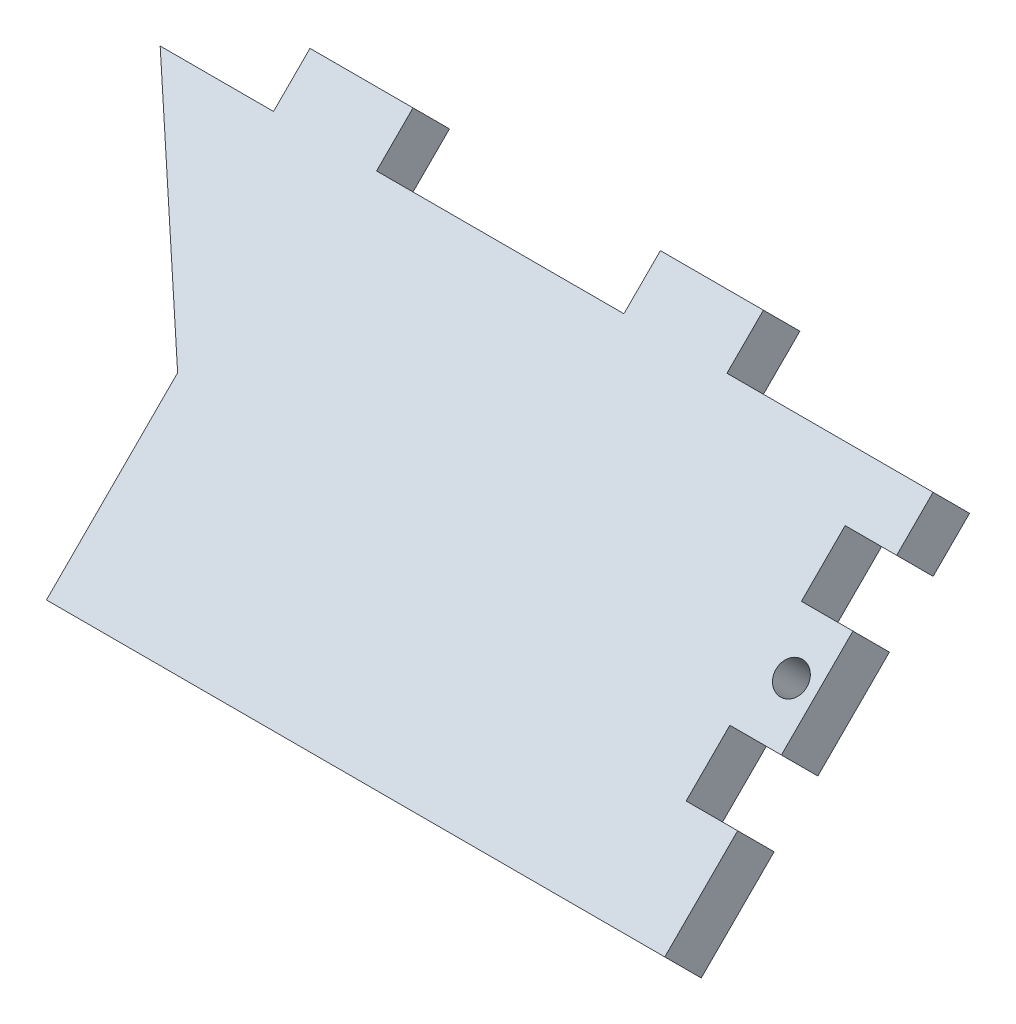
SolidWorks part; units mm, degrees
ref_plane "Front Plane" through (0, 0, 0) normal (0, 0, 1) x (1, 0, 0)
ref_plane "Top Plane" through (0, 0, 0) normal (0, 1, 0) x (1, 0, 0)
ref_plane "Right Plane" through (0, 0, 0) normal (1, 0, 0) x (0, 0, -1)
sketch "Sketch1" plane through (0, 0, 0) normal (1, 0, 0) x (0, 0, -1)
  line L0 (0, 0) -> (38.1, 0) construction
  line L1 (38.1, 0) -> (38.1, 38.1) construction
  line L2 (38.1, 38.1) -> (0, 0) construction
  dimension "D1" = 38.1
  dimension "D2" = 38.1
sketch "Sketch2" plane through (0, 0, 0) normal (0, 0, 1) x (1, 0, 0)
  line L0 (0, 0) -> (-49.1829, 0) construction
ref_plane "Plane1" through (0, 0, 0) normal (0, 0.7071, 0.7071) x (1, 0, 0)
sketch "Sketch3" plane through (0, 0, 0) normal (0, 0.7071, 0.7071) x (1, 0, 0)
  line L0 (0, 0) -> (0, 53.1089)
  line L1 (0, 53.1089) -> (-95.25, 53.1089)
  line L2 (0, 0) -> (-76.2, 0)
  line L3 (-76.2, 0) -> (-76.2, 22.86)
  line L5 (-95.25, 53.1089) -> (-95.25, 46.7589)
  line L6 (-95.25, 46.7589) -> (-76.2, 22.86)
  line L12 (-25.4, 53.1089) -> (0, 53.1089)
  line L13 (-25.4, 53.1089) -> (-25.4, 46.7589)
  line L14 (-25.4, 46.7589) -> (0, 46.7589)
  line L15 (0, 53.1089) -> (0, 46.7589)
  line L16 (-68.58, 53.1089) -> (-38.1, 53.1089)
  line L17 (-68.58, 53.1089) -> (-68.58, 46.7589)
  line L18 (-68.58, 46.7589) -> (-38.1, 46.7589)
  line L19 (-38.1, 53.1089) -> (-38.1, 46.7589)
  line L20 (-95.25, 53.1089) -> (-81.28, 53.1089)
  line L21 (-95.25, 53.1089) -> (-95.25, 46.7589)
  line L22 (-95.25, 46.7589) -> (-81.28, 46.7589)
  line L23 (-81.28, 53.1089) -> (-81.28, 46.7589)
  line L28 (0, 40.4114) -> (-6.35, 40.4114)
  line L29 (0, 40.4114) -> (0, 32.7914)
  line L30 (0, 32.7914) -> (-6.35, 32.7914)
  line L31 (-6.35, 40.4114) -> (-6.35, 32.7914)
  line L32 (0, 20.32) -> (-6.35, 20.32)
  line L33 (0, 20.32) -> (0, 12.7)
  line L34 (0, 12.7) -> (-6.35, 12.7)
  line L35 (-6.35, 20.32) -> (-6.35, 12.7)
  point P17 (-68.58, 49.9339)
  dimension "D1" = 95.25
  dimension "D2" = 76.2
  dimension "D3" = 53.1089
  dimension "D4" = 22.86
  dimension "D5" = 6.35
  dimension "D6" = 25.4
  dimension "D7" = 12.7
  dimension "D8" = 30.48
  dimension "D9" = 12.7
  dimension "D10" = 6.35
  dimension "D11" = 6.35
  dimension "D12" = 6.35
  dimension "D13" = 12.7
  dimension "D14" = 12.4714
  dimension "D15" = 7.62
  dimension "D16" = 6.35
  dimension "D17" = 6.35
  dimension "D18" = 7.62
extrude "Boss-Extrude7" add sketch "Sketch3" along normal blind 6.35 contours L35 L32 L0 L30 L31 L28 L14 L13 L1 L19 L18 L17 L23 L22 L5 L6 L3 L2 L34
sketch "Sketch7" plane through (0, 4.4901, 4.4901) normal (0, 0.7071, 0.7071) x (1, 0, 0)
  line L0 (-3.175, 32.7914) -> (-3.175, 20.32) construction
  line L1 (0, 32.7914) -> (-6.35, 32.7914) construction
  line L2 (0, 20.32) -> (-6.35, 20.32) construction
  circle A0 centre (-3.175, 26.5557) radius 1.905
  dimension "D1" = 3.81
extrude "Cut-Extrude1" cut sketch "Sketch7" against normal blind 6.35
